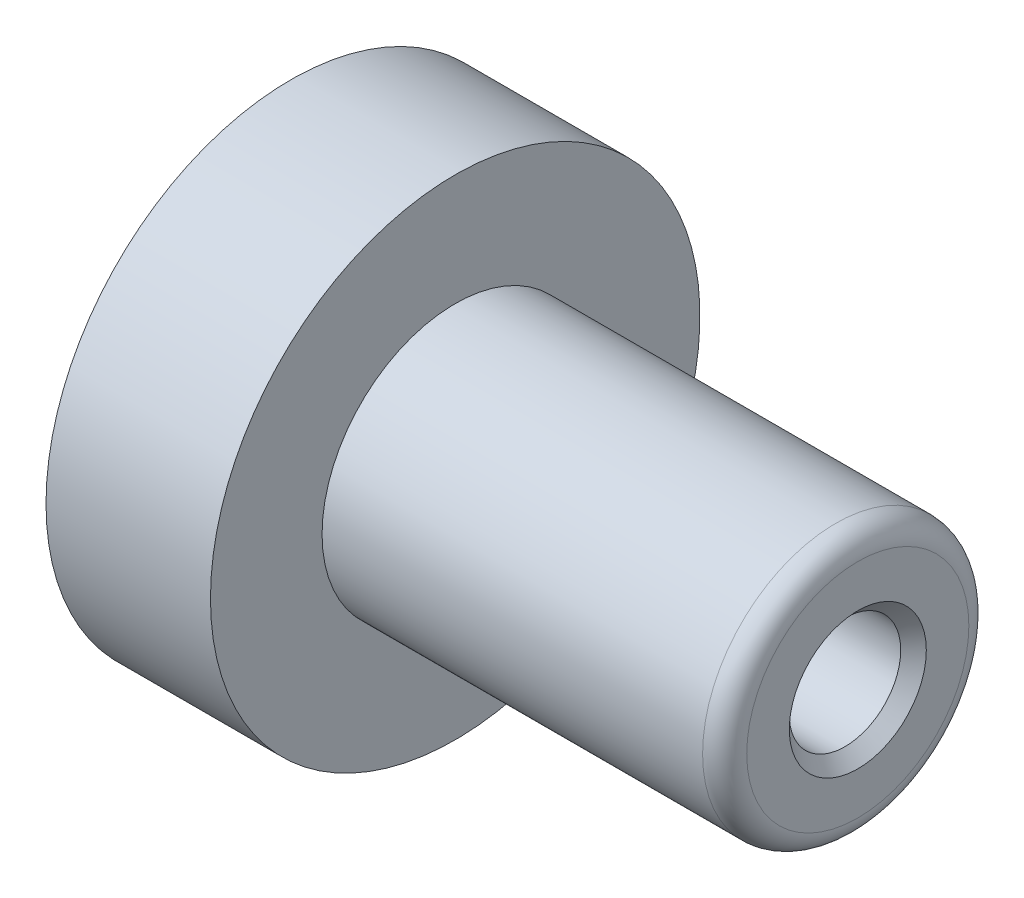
SolidWorks part; units mm, degrees
ref_plane "Front Plane" through (0, 0, 0) normal (0, 0, 1) x (1, 0, 0)
ref_plane "Top Plane" through (0, 0, 0) normal (0, 1, 0) x (1, 0, 0)
ref_plane "Right Plane" through (0, 0, 0) normal (1, 0, 0) x (0, 0, -1)
sketch "Sketch1" plane through (0, 0, 0) normal (0, 0, 1) x (1, 0, 0)
  line L0 (0, 0) -> (102.3864, 0) construction
  line L1 (0, 6.7437) -> (0, 17.4625)
  line L2 (0, 17.4625) -> (11.7348, 17.4625)
  line L3 (11.7348, 17.4625) -> (11.7348, 9.4996)
  line L4 (11.7348, 9.4996) -> (38.8874, 9.4996)
  line L5 (40.4622, 7.9248) -> (40.4622, 0)
  line L6 (40.4622, 0) -> (20.4724, 0)
  line L7 (0, 6.7437) -> (20.4724, 6.7437)
  line L8 (20.4724, 6.7437) -> (20.4724, 0)
  arc A0 (40.4622, 7.9248) -> (38.8874, 9.4996) centre (38.8874, 7.9248) ccw
  dimension "D5" = 1.5748
  dimension "D1" = 11.7348
  dimension "D2" = 34.925
  dimension "D3" = 20.4724
  dimension "D4" = 13.4874
  dimension "D6" = 40.4622
  dimension "D7" = 18.9992
revolve "Revolve1" add sketch "Sketch1" angle 360 about L0
sketch "Sketch2" plane through (0, 0, 0) normal (-1, 0, 0) x (0, 0, 1)
  line L0 (0, 0) -> (9.7644, 0) construction
  circle A0 centre (0, 11.1125) radius 1.6129
  circle A1 centre (0, -11.1125) radius 1.6129
  dimension "D2" = 3.2258
  dimension "D1" = 22.225
extrude "Cut-Extrude1" cut sketch "Sketch2" against normal blind 6.35
sketch "Sketch3" plane through (40.4622, 0, 0) normal (1, 0, 0) x (0, 0, -1)
  circle A0 centre (0, 0) radius 3.9751
  dimension "D1" = 7.9502
extrude "Cut-Extrude2" cut sketch "Sketch3" against normal blind 17.4752
chamfer "Chamfer1" distance 0.9144 angle 45 1 edges at (40.4622, 0, -3.9751)
